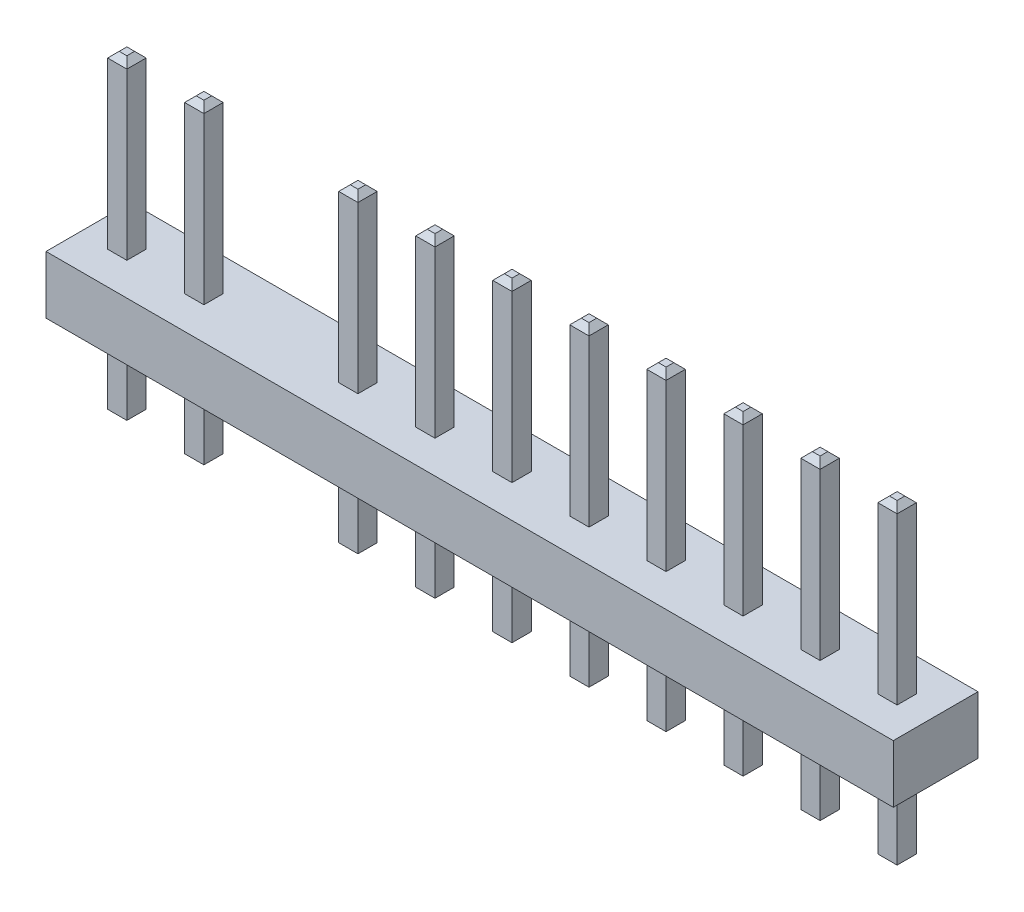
SolidWorks part; units mm, degrees
ref_plane "Front Plane" through (0, 0, 0) normal (0, 0, 1) x (1, 0, 0)
ref_plane "Top Plane" through (0, 0, 0) normal (0, 1, 0) x (1, 0, 0)
ref_plane "Right Plane" through (0, 0, 0) normal (1, 0, 0) x (0, 0, -1)
sketch "Sketch1" plane through (0, 0, 0) normal (0, 1, 0) x (1, 0, 0)
  line L1 (0, 0) -> (22, 0)
  line L2 (0, 0) -> (0, 2.2)
  line L3 (0, 2.2) -> (22, 2.2)
  line L4 (22, 0) -> (22, 2.2)
  dimension "D1" = 2.2
  dimension "D2" = 22
extrude "Boss-Extrude1" add sketch "Sketch1" against normal blind 1.5
sketch "Sketch2" plane through (0, 0, 0) normal (0, 1, 0) x (1, 0, 0)
  line L0 (1.25, 0.85) -> (0.75, 1.35) construction
  line L1 (0.75, 1.35) -> (1.25, 1.35)
  line L2 (0.75, 1.35) -> (0.75, 0.85)
  line L3 (0.75, 0.85) -> (1.25, 0.85)
  line L4 (1.25, 1.35) -> (1.25, 0.85)
  line L5 (1, 1.1) -> (1, 2.2) construction
  line L6 (22, 2.2) -> (0, 2.2) construction
  line L7 (0, 1.1) -> (1, 1.1) construction
  line L8 (0, 2.2) -> (0, 0) construction
  line L9 (2.75, 1.35) -> (3.25, 1.35) construction
  line L10 (2.75, 1.35) -> (2.75, 0.85) construction
  line L11 (2.75, 0.85) -> (3.25, 0.85) construction
  line L12 (3.25, 1.35) -> (3.25, 0.85) construction
  line L13 (3.25, 0.85) -> (2.75, 1.35) construction
  line L14 (4.75, 1.35) -> (5.25, 1.35) construction
  line L15 (4.75, 1.35) -> (4.75, 0.85) construction
  line L16 (4.75, 0.85) -> (5.25, 0.85) construction
  line L17 (5.25, 1.35) -> (5.25, 0.85) construction
  line L18 (5.25, 0.85) -> (4.75, 1.35) construction
  line L19 (6.75, 1.35) -> (7.25, 1.35) construction
  line L20 (6.75, 1.35) -> (6.75, 0.85) construction
  line L21 (6.75, 0.85) -> (7.25, 0.85) construction
  line L22 (7.25, 1.35) -> (7.25, 0.85) construction
  line L23 (7.25, 0.85) -> (6.75, 1.35) construction
  line L24 (8.75, 1.35) -> (9.25, 1.35) construction
  line L25 (8.75, 1.35) -> (8.75, 0.85) construction
  line L26 (8.75, 0.85) -> (9.25, 0.85) construction
  line L27 (9.25, 1.35) -> (9.25, 0.85) construction
  line L28 (9.25, 0.85) -> (8.75, 1.35) construction
  line L29 (10.75, 1.35) -> (11.25, 1.35) construction
  line L30 (10.75, 1.35) -> (10.75, 0.85) construction
  line L31 (10.75, 0.85) -> (11.25, 0.85) construction
  line L32 (11.25, 1.35) -> (11.25, 0.85) construction
  line L33 (11.25, 0.85) -> (10.75, 1.35) construction
  line L34 (12.75, 1.35) -> (13.25, 1.35) construction
  line L35 (12.75, 1.35) -> (12.75, 0.85) construction
  line L36 (12.75, 0.85) -> (13.25, 0.85) construction
  line L37 (13.25, 1.35) -> (13.25, 0.85) construction
  line L38 (13.25, 0.85) -> (12.75, 1.35) construction
  line L39 (14.75, 1.35) -> (15.25, 1.35) construction
  line L40 (14.75, 1.35) -> (14.75, 0.85) construction
  line L41 (14.75, 0.85) -> (15.25, 0.85) construction
  line L42 (15.25, 1.35) -> (15.25, 0.85) construction
  line L43 (15.25, 0.85) -> (14.75, 1.35) construction
  line L44 (16.75, 1.35) -> (17.25, 1.35) construction
  line L45 (16.75, 1.35) -> (16.75, 0.85) construction
  line L46 (16.75, 0.85) -> (17.25, 0.85) construction
  line L47 (17.25, 1.35) -> (17.25, 0.85) construction
  line L48 (17.25, 0.85) -> (16.75, 1.35) construction
  line L49 (18.75, 1.35) -> (19.25, 1.35) construction
  line L50 (18.75, 1.35) -> (18.75, 0.85) construction
  line L51 (18.75, 0.85) -> (19.25, 0.85) construction
  line L52 (19.25, 1.35) -> (19.25, 0.85) construction
  line L53 (19.25, 0.85) -> (18.75, 1.35) construction
  line L54 (20.75, 1.35) -> (21.25, 1.35) construction
  line L55 (20.75, 1.35) -> (20.75, 0.85) construction
  line L56 (20.75, 0.85) -> (21.25, 0.85) construction
  line L57 (21.25, 1.35) -> (21.25, 0.85) construction
  line L58 (21.25, 0.85) -> (20.75, 1.35) construction
  point P9 (3, 1.1)
  dimension "D1" = 1
  dimension "D2" = 0.5
  dimension "D4" = 2
  dimension "D3" = 11
extrude "Boss-Extrude2" add sketch "Sketch2" along normal blind 4.45 and the other way blind 3.75
chamfer "Chamfer1" distance 0.15 angle 45 8 edges at (1, 4.45, -1.35) (1.25, 4.45, -1.1) (1, 4.45, -0.85) (0.75, 4.45, -1.1) (1, -3.75, -0.85) (1.25, -3.75, -1.1) (1, -3.75, -1.35) (0.75, -3.75, -1.1)
pattern_linear "LPattern1" count 11 spacing 2 along (1, 0, 0) of "Boss-Extrude2", "Chamfer1"
